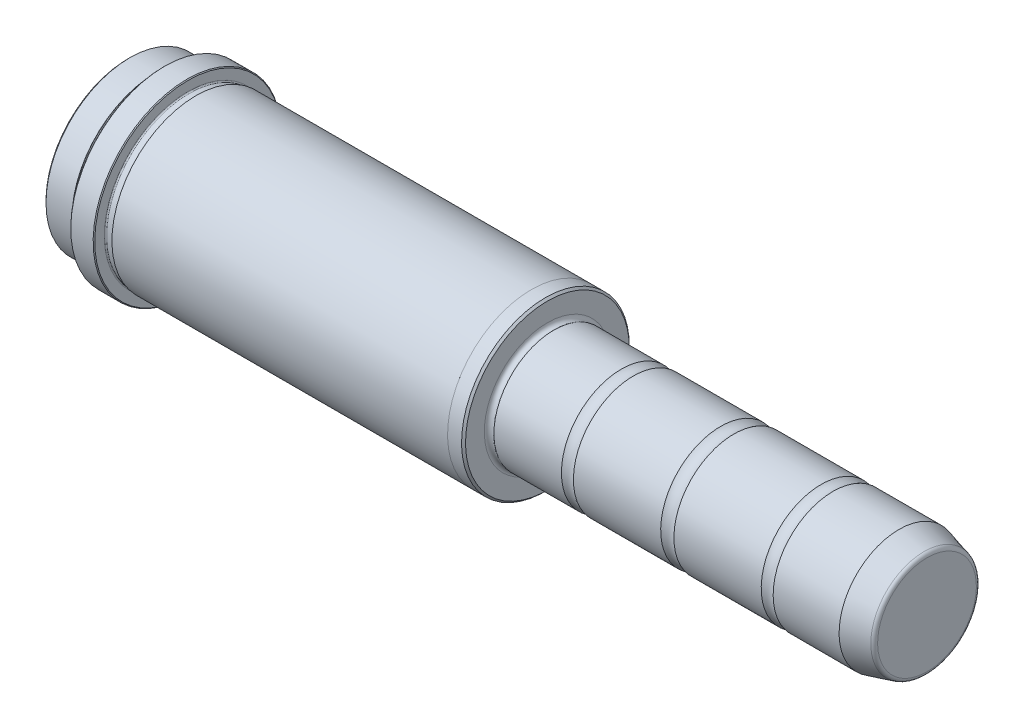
SolidWorks part; units mm, degrees
ref_plane "Front Plane" through (0, 0, 0) normal (0, 0, 1) x (1, 0, 0)
ref_plane "Top Plane" through (0, 0, 0) normal (0, 1, 0) x (1, 0, 0)
ref_plane "Right Plane" through (0, 0, 0) normal (1, 0, 0) x (0, 0, -1)
sketch "Sketch1" plane through (0, 0, 0) normal (0, 0, 1) x (1, 0, 0)
  line L0 (95, 13.1244) -> (88, 15)
  line L1 (88, 15) -> (1.6, 15)
  line L2 (0, 15.8) -> (0, 21)
  line L3 (0, 21) -> (-4, 21)
  line L4 (-88, 21.0001) -> (-88, 20.9)
  line L5 (-88.3, 20.6) -> (-89.7, 20.6)
  line L6 (-90, 20.9) -> (-90, 23.5)
  line L7 (-90, 23.5) -> (-96, 23.5)
  line L8 (-96, 23.5) -> (-96, 20.9)
  line L9 (-96.3, 20.6) -> (-97.7, 20.6)
  line L10 (-98, 20.9) -> (-98, 21)
  line L11 (-98, 21) -> (-105, 21)
  line L12 (-105, 21) -> (-105, 0)
  line L13 (95, 13.1244) -> (95, 0)
  line L14 (95, 0) -> (-95, 0) construction
  line L15 (95, 0) -> (-105, 0)
  line L16 (-4, 21.0001) -> (-88, 21.0001)
  line L17 (-4, 21.0001) -> (-4, 21)
  arc A0 (0, 15.8) -> (1.6, 15) centre (1, 15.8) ccw
  arc A1 (-96, 20.9) -> (-96.3, 20.6) centre (-96.3, 20.9) cw
  arc A2 (-97.7, 20.6) -> (-98, 20.9) centre (-97.7, 20.9) cw
  arc A3 (-89.7, 20.6) -> (-90, 20.9) centre (-89.7, 20.9) cw
  arc A4 (-88, 20.9) -> (-88.3, 20.6) centre (-88.3, 20.9) cw
  point P16 (0, 0)
  point P28 (-90, 20.6)
  point P31 (-88, 20.6)
  dimension "ShoulderRadii" = 2
  dimension "D5" = 0.3
  dimension "D1" = 15
  dimension "D2" = 0.4
  dimension "PinDia" = 30
  dimension "ChamferLeadIn" = 7
  dimension "ShoulderDia" = 42
  dimension "PinLengthN" = 95
  dimension "ShoulderLength" = 96
  dimension "D3" = 0.0001
  dimension "ShoulderGap" = 2
  dimension "D4" = 4
  dimension "T" = 6
  dimension "CollarLength" = 9
  dimension "HeadDia" = 47
  dimension "D8" = 0.2
revolve "Revolve1" add sketch "Sketch1" angle 360 about L14
sketch "Sketch2" plane through (0, 0, 0) normal (0, 0, 1) x (1, 0, 0)
  line L0 (95, -13.1244) -> (95, 13.1244) construction
  line L1 (145.9417, 14.6) -> (148.0583, 14.6) construction
  line L2 (88, 15) -> (1.6, 15) construction
  line L4 (68.5033, 15) -> (71.4967, 15)
  arc A0 (68.5033, 15) -> (71.4967, 15) centre (70, 17.6) ccw
  dimension "GrooveRadius" = 3
  dimension "D3" = 0.4
  dimension "AGroove" = 25
revolve "Groove A" cut sketch "Sketch2" angle 360 about axis through (95, 0, 0) along (1, 0, 0)
sketch "Sketch3" plane through (0, 0, 0) normal (0, 0, 1) x (1, 0, 0)
  line L0 (68.5033, 15) -> (1.6, 15) construction
  line L3 (43.3417, 15) -> (46.6583, 15)
  arc A0 (43.3417, 15) -> (46.6583, 15) centre (45, 17.5) ccw
  arc A1 (68.5033, 15) -> (71.4967, 15) centre (70, 17.6) ccw construction
  dimension "D1" = 0.5
  dimension "GroovePitch" = 25
revolve "Groove B" cut sketch "Sketch3" angle 360 about axis through (95, 0, 0) along (1, 0, 0)
sketch "Sketch4" plane through (0, 0, 0) normal (0, 0, 1) x (1, 0, 0)
  line L2 (43.3417, 15) -> (1.6, 15) construction
  line L3 (18.5033, 15) -> (21.4967, 15)
  arc A0 (18.5033, 15) -> (21.4967, 15) centre (20, 17.6) ccw
  arc A3 (43.3417, 15) -> (46.6583, 15) centre (45, 17.5) ccw construction
  dimension "D1" = 0.4
revolve "Groove C" cut sketch "Sketch4" angle 360 about axis through (95, 0, 0) along (1, 0, 0)
sketch "Sketch5" plane through (0, 0, 0) normal (0, 0, 1) x (1, 0, 0)
  line L0 (-6.4967, 15) -> (-3.5033, 15)
  line L1 (18.5033, 15) -> (1.6, 15) construction
  arc A0 (-6.4967, 15) -> (-3.5033, 15) centre (-5, 17.6) ccw
  arc A3 (18.5033, 15) -> (21.4967, 15) centre (20, 17.6) ccw construction
  dimension "D1" = 0.4
revolve "Groove D" [suppressed] cut sketch "Sketch5" angle 360
fillet "Fillet1" radius 1 1 edges at (95, 13.1244, 0)
chamfer "Chamfer1" distance 0.2 angle 45 2 edges at (-96, 23.5, 0) (-90, 23.5, 0)
chamfer "Chamfer2" distance 0.5 angle 45 2 edges at (-105, 21, 0) (0, 21, 0)
